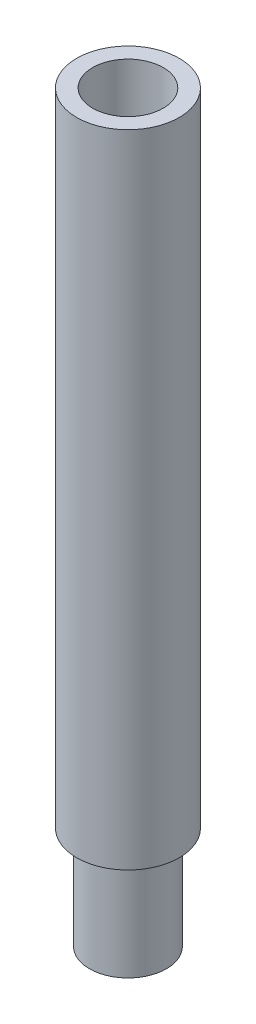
SolidWorks part; units mm, degrees
ref_plane "Front Plane" through (0, 0, 0) normal (0, 0, 1) x (1, 0, 0)
ref_plane "Top Plane" through (0, 0, 0) normal (0, 1, 0) x (1, 0, 0)
ref_plane "Right Plane" through (0, 0, 0) normal (1, 0, 0) x (0, 0, -1)
sketch "Sketch1" plane through (0, 0, 0) normal (0, 0, 1) x (1, 0, 0)
  line L0 (0, 0) -> (9.525, 0)
  line L1 (9.525, 0) -> (9.525, 25.4)
  line L2 (9.525, 25.4) -> (12.7, 25.4)
  line L3 (12.7, 25.4) -> (12.7, 184.15)
  line L4 (12.7, 184.15) -> (8.7312, 184.15)
  line L5 (8.7312, 184.15) -> (8.7312, 155.575)
  line L6 (8.7312, 155.575) -> (0, 155.575)
  line L7 (0, 155.575) -> (0, 0)
  line L8 (0, 0) -> (0, -16.0259) construction
  dimension "D1" = 19.05
  dimension "D2" = 25.4
  dimension "D3" = 158.75
  dimension "D4" = 25.4
  dimension "D5" = 17.4625
  dimension "D6" = 28.575
revolve "Revolve1" add sketch "Sketch1" angle 360 about L8
hole_wizard "5/16-24 Tapped Hole1" positions "Sketch3" profile "Sketch2" tap size "5/16-24" standard "Example Inch"
sketch "Sketch3" plane through (0, 0, 0) normal (0, -1, 0) x (1, 0, 0)
  point P0 (0, 0)
sketch "Sketch2" plane through (0, 0, 0) normal (1, 0, 0) x (0, 0, -1)
  line L0 (0, 0) -> (0, 23.4116)
  line L1 (0, 23.4116) -> (3.4544, 21.336)
  line L2 (3.4544, 21.336) -> (3.4544, 0)
  line L5 (3.4544, 0) -> (0, 0)
  line L10 (0, 23.4116) -> (-3.4544, 21.336) construction
  line L11 (0, -6.35) -> (0, 107.95) construction
  dimension "Tap Drill Dia." = 6.9088
  dimension "Tap Drill Depth" = 21.336
  dimension "Drill Angle" = 118
